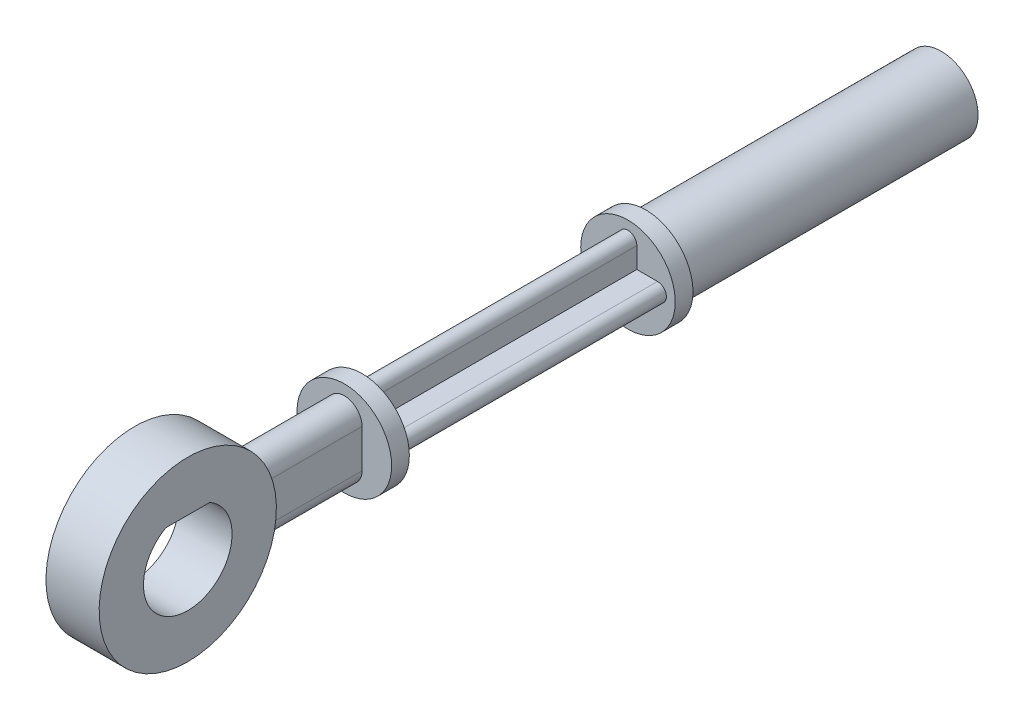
SolidWorks part; units mm, degrees
ref_plane "Front" through (0, 0, 0) normal (0, 0, 1) x (1, 0, 0)
ref_plane "Top" through (0, 0, 0) normal (0, 1, 0) x (1, 0, 0)
ref_plane "Right" through (0, 0, 0) normal (1, 0, 0) x (0, 0, -1)
sketch "Sketch1" plane through (0, 0, 0) normal (0, 0, 1) x (1, 0, 0)
  circle A0 centre (0, 0) radius 16
  dimension "D1" = 32
extrude "Base-Extrude" add sketch "Sketch1" along normal mid plane 6
sketch "Sketch2" plane through (0, 0, 3) normal (0, 0, 1) x (1, 0, 0)
  line L0 (0, 6.5) -> (0, -6.5) construction
  line L1 (6, 6.5) -> (6, -6.5)
  line L2 (-6, 6.5) -> (-6, -6.5)
  arc A0 (6, 6.5) -> (-6, 6.5) centre (0, 6.5) ccw
  arc A1 (-6, -6.5) -> (6, -6.5) centre (0, -6.5) ccw
  point P2 (0, 0)
  dimension "D1" = 12
  dimension "D2" = 25
ref_plane "Plane1" through (0, 0, 65) normal (0, 0, 1) x (1, 0, 0)
extrude "Extrude3" add sketch "Sketch2" along normal up to surface (62 mm away)
sketch "Sketch5" plane through (0, 0, -3) normal (0, 0, -1) x (-1, 0, 0)
  line L0 (-3, 3) -> (-3, 10)
  line L1 (3, 10) -> (3, 3)
  line L2 (3, 3) -> (10, 3)
  line L3 (10, -3) -> (3, -3)
  line L4 (3, -3) -> (3, -10)
  line L5 (-3, -10) -> (-3, -3)
  line L6 (-3, -3) -> (-10, -3)
  line L7 (-10, 3) -> (-3, 3)
  line L8 (-10, 0) -> (10, 0) construction
  line L9 (0, 10) -> (0, -10) construction
  arc A0 (-3, 10) -> (3, 10) centre (0, 10) cw
  arc A1 (10, 3) -> (10, -3) centre (10, 0) cw
  arc A2 (3, -10) -> (-3, -10) centre (0, -10) cw
  arc A3 (-10, -3) -> (-10, 3) centre (-10, 0) cw
  dimension "D1" = 26
  dimension "D3" = 26
  dimension "D2" = 6
extrude "Boss-Extrude1" add sketch "Sketch5" along normal blind 90
sketch "Sketch6" plane through (0, 0, -93) normal (0, 0, -1) x (-1, 0, 0)
  circle A0 centre (0, 0) radius 16 construction
  circle A1 centre (0, 0) radius 16
extrude "Boss-Extrude2" add sketch "Sketch6" along normal blind 6
sketch "Sketch7" plane through (0, 0, -99) normal (0, 0, -1) x (-1, 0, 0)
  circle A0 centre (0, 0) radius 12.5
  point P3 (12.5, 0)
  dimension "D1" = 25
sketch "Sketch9" plane through (0, 0, 65) normal (0, 0, 1) x (1, 0, 0)
  line L1 (-9, 30) -> (9, 30)
  line L2 (9, 30) -> (9, 0)
  line L4 (9, 0) -> (-9, 0)
  line L5 (-9, 0) -> (-9, 30)
  line L6 (9, 0) -> (54.9339, 0) construction
  dimension "D1" = 60
  dimension "D2" = 18
revolve "Boss-Revolve1" add sketch "Sketch9" angle 360 about L6
sketch "Sketch10" plane through (9, 0, 0) normal (1, 0, 0) x (0, 0, -1)
  line L0 (-72.4833, 13) -> (-57.5167, 13)
  arc A0 (-72.4833, 13) -> (-57.5167, 13) centre (-65, 0) ccw
  dimension "D1" = 30
  dimension "D2" = 28
extrude "Cut-Extrude1" cut sketch "Sketch10" against normal through all
extrude "Extrude4" add sketch "Sketch7" along normal blind 100
